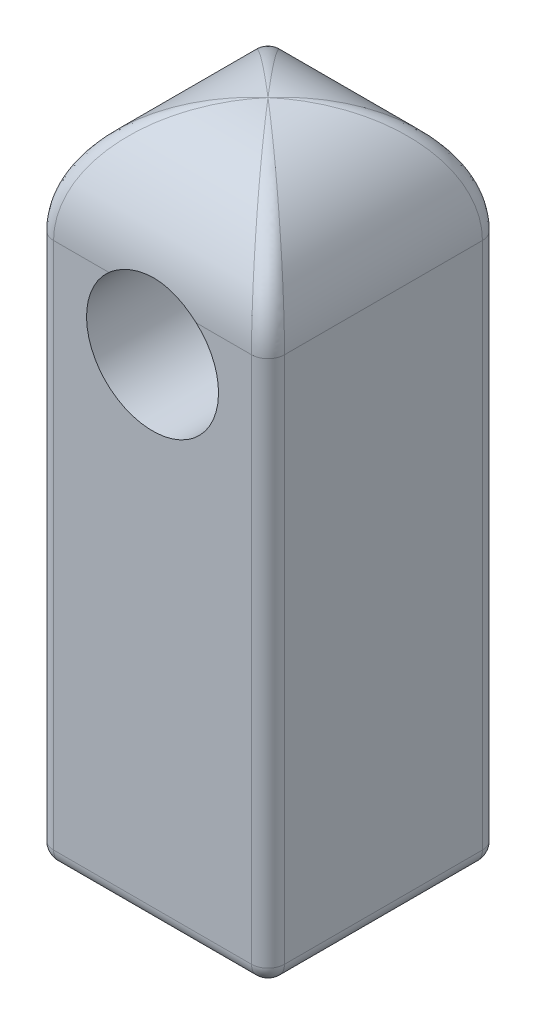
SolidWorks part; units mm, degrees
ref_plane "Front Plane" through (0, 0, 0) normal (0, 0, 1) x (1, 0, 0)
ref_plane "Top Plane" through (0, 0, 0) normal (0, 1, 0) x (1, 0, 0)
ref_plane "Right Plane" through (0, 0, 0) normal (1, 0, 0) x (0, 0, -1)
sketch "Sketch1" plane through (0, 0, 0) normal (0, 0, 1) x (1, 0, 0)
  line L0 (0, 5) -> (0, -15) construction
  line L1 (-3.5, 5) -> (3.5, 5)
  line L2 (-3.5, 5) -> (-3.5, -15)
  line L3 (-3.5, -15) -> (3.5, -15)
  line L4 (3.5, 5) -> (3.5, -15)
  circle A0 centre (0, 0) radius 2
  dimension "D4" = 4
  dimension "D1" = 7
  dimension "D2" = 20
  dimension "D3" = 5
extrude "Boss-Extrude1" add sketch "Sketch1" along normal mid plane 7
fillet "Fillet1" radius 3.5 4 edges at (0, 5, -3.5) (0, 5, 3.5) (3.5, 5, 0) (-3.5, 5, 0)
fillet "Fillet2" radius 0.5 12 edges at (3.5, -15, 0) (3.5, -6.75, 3.5) (3.5, -6.75, -3.5) (-3.5, -6.75, 3.5) (-3.5, -15, 0) (-3.5, -6.75, -3.5) (0, -15, 3.5) (0, -15, -3.5) (2.4749, 3.9749, 2.4749) (-2.4749, 3.9749, -2.4749) (2.4749, 3.9749, -2.4749) (-2.4749, 3.9749, 2.4749)
